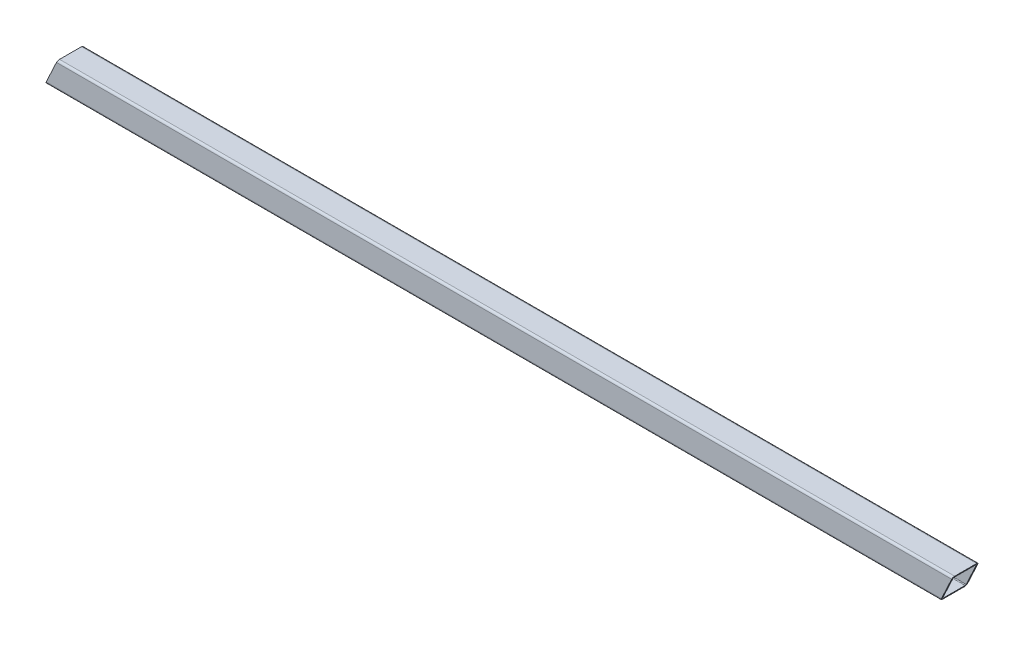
SolidWorks part; units mm, degrees
ref_plane "Front Plane" through (0, 0, 0) normal (0, 0, 1) x (1, 0, 0)
ref_plane "Top Plane" through (0, 0, 0) normal (0, 1, 0) x (1, 0, 0)
ref_plane "Right Plane" through (0, 0, 0) normal (1, 0, 0) x (0, 0, -1)
sketch "Sketch1" plane through (0, 0, 0) normal (1, 0, 0) x (0, 0, -1)
  line L0 (0, 2.54) -> (0, 29.21)
  line L1 (-2.54, 31.75) -> (-29.21, 31.75)
  line L2 (-31.75, 29.21) -> (-31.75, 2.54)
  line L3 (-29.21, 0) -> (-2.54, 0)
  line L4 (-1.651, 2.54) -> (-1.651, 29.21)
  line L5 (-2.54, 30.099) -> (-29.21, 30.099)
  line L6 (-30.099, 29.21) -> (-30.099, 2.54)
  line L7 (-29.21, 1.651) -> (-2.54, 1.651)
  arc A0 (-31.75, 2.54) -> (-29.21, 0) centre (-29.21, 2.54) ccw
  arc A1 (0, 2.54) -> (-2.54, 0) centre (-2.54, 2.54) cw
  arc A2 (0, 29.21) -> (-2.54, 31.75) centre (-2.54, 29.21) ccw
  arc A3 (-31.75, 29.21) -> (-29.21, 31.75) centre (-29.21, 29.21) cw
  arc A4 (-1.651, 29.21) -> (-2.54, 30.099) centre (-2.54, 29.21) ccw
  arc A5 (-30.099, 29.21) -> (-29.21, 30.099) centre (-29.21, 29.21) cw
  arc A6 (-30.099, 2.54) -> (-29.21, 1.651) centre (-29.21, 2.54) ccw
  arc A7 (-1.651, 2.54) -> (-2.54, 1.651) centre (-2.54, 2.54) cw
  point P12 (0, 0)
  point P15 (0, 31.75)
  point P18 (-31.75, 31.75)
  dimension "D3" = 2.54
  dimension "D1" = 31.75
  dimension "D2" = 31.75
  dimension "D4" = 1.651
extrude "Boss-Extrude1" add sketch "Sketch1" along normal blind 1320.8
sketch "Sketch2" plane through (1320.8, 0, 0) normal (1, 0, 0) x (0, 0, -1)
  line L0 (-31.75, 15.875) -> (0, 15.875)
  line L1 (-31.75, 29.21) -> (-31.75, 2.54) construction
  line L2 (0, 2.54) -> (0, 29.21) construction
scale "Scale4" bodies to scale 101 scale about centroid uniform scaling no x scale factor 1 y scale factor 0.4 z scale factor 0.4
sketch "Sketch3" plane through (0, 0, 22.225) normal (0, 0, 1) x (1, 0, 0)
  line L0 (497.1874, 5.16) -> (507.5034, 27.2828)
  line L1 (507.5034, 27.2828) -> (-75.2816, 76.2088)
  line L2 (-75.2816, 76.2088) -> (44.8143, -65.8997)
  line L3 (44.8143, -65.8997) -> (497.1874, 5.16)
  line L4 (0, 21.209) -> (0, 10.541) construction
  line L5 (1320.8, 10.541) -> (0, 10.541) construction
  dimension "D1" = 44.8143
  dimension "D2" = 497.1874
  dimension "D3" = 507.5034
  dimension "D4" = 75.2816
  dimension "D5" = 16.7418
  dimension "D6" = 65.6678
  dimension "D7" = 5.381
  dimension "D8" = 76.4407
extrude "Cut-Extrude1" cut sketch "Sketch3" against normal through all
sketch "Sketch4" plane through (0, 0, 22.225) normal (0, 0, 1) x (1, 0, 0)
  line L0 (927.7024, -3.1711) -> (947.2164, 38.6767)
  line L1 (947.2164, 38.6767) -> (1343.3775, 38.6767)
  line L2 (1343.3775, 38.6767) -> (1343.3775, -18.6869)
  line L3 (1343.3775, -18.6869) -> (927.7024, -3.1711)
  line L4 (1320.8, 21.209) -> (504.6712, 21.209) construction
  dimension "D1" = 22.5775
  dimension "D2" = 373.5836
  dimension "D3" = 393.0976
  dimension "D4" = 17.4677
  dimension "D5" = 24.3801
  dimension "D6" = 39.8959
extrude "Cut-Extrude2" cut sketch "Sketch4" against normal through all
